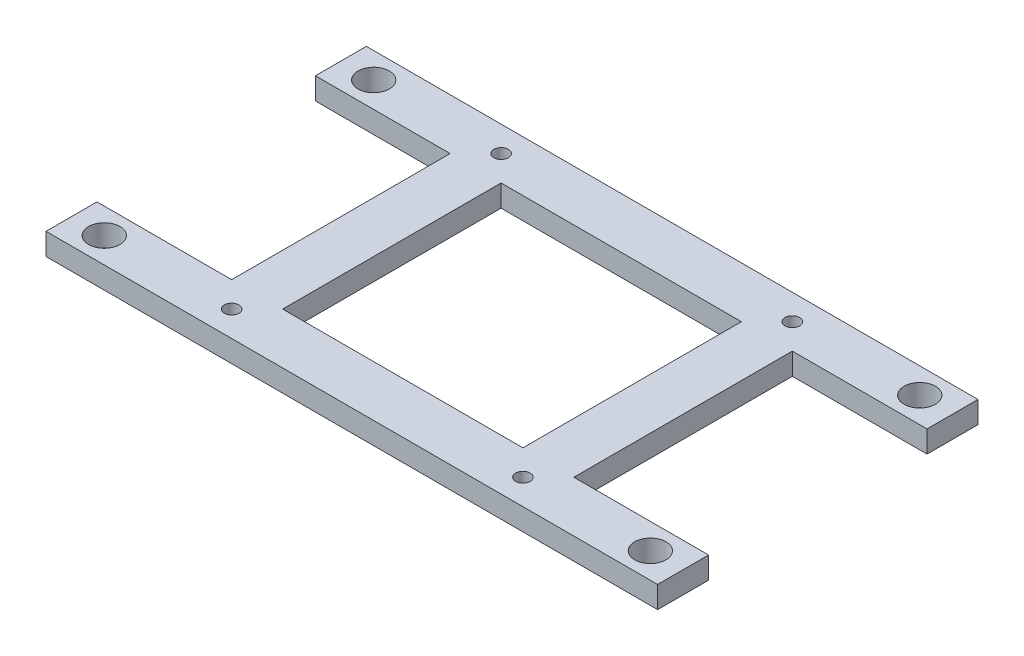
SolidWorks part; units mm, degrees
ref_plane "Front Plane" through (0, 0, 0) normal (0, 0, 1) x (1, 0, 0)
ref_plane "Top Plane" through (0, 0, 0) normal (0, 1, 0) x (1, 0, 0)
ref_plane "Right Plane" through (0, 0, 0) normal (1, 0, 0) x (0, 0, -1)
sketch "Sketch1" plane through (0, 0, 0) normal (0, 1, 0) x (1, 0, 0)
  line L0 (0, 18.5) -> (0, -18.5) construction
  line L1 (42, -18.5) -> (-42, -18.5) construction
  line L2 (42, -18.5) -> (42, 18.5) construction
  line L3 (42, 18.5) -> (-42, 18.5) construction
  line L4 (-42, -18.5) -> (-42, 18.5) construction
  line L5 (42, -18.5) -> (-42, 18.5) construction
  line L6 (42, 18.5) -> (-42, -18.5) construction
  line L7 (-42, 22) -> (42, 22)
  line L8 (42, 22) -> (42, 15)
  line L9 (42, 15) -> (23.5, 15)
  line L10 (23.5, 15) -> (23.5, -15)
  line L11 (23.5, -15) -> (42, -15)
  line L12 (42, -15) -> (42, -22)
  line L13 (42, -22) -> (-42, -22)
  line L14 (-42, -22) -> (-42, -15)
  line L15 (-42, -15) -> (-23.5, -15)
  line L16 (-23.5, -15) -> (-23.5, 15)
  line L17 (-23.5, 15) -> (-42, 15)
  line L18 (-42, 15) -> (-42, 22)
  line L19 (-16.5, 3.5843) -> (-23.5, 3.5843) construction
  line L20 (16.5, -15) -> (-16.5, -15)
  line L21 (16.5, -15) -> (16.5, 15)
  line L22 (16.5, 15) -> (-16.5, 15)
  line L23 (-16.5, -15) -> (-16.5, 15)
  line L24 (16.5, -15) -> (-16.5, 15) construction
  line L25 (16.5, 15) -> (-16.5, -15) construction
  line L26 (20, 18.5) -> (20, -18.5) construction
  circle A0 centre (-20, 18.5) radius 1
  circle A1 centre (20, 18.5) radius 1
  circle A2 centre (20, -18.5) radius 1
  circle A3 centre (-20, -18.5) radius 1
  circle A4 centre (-37.5, 18.5) radius 2.15
  circle A5 centre (-37.5, -18.5) radius 2.15
  circle A6 centre (37.5, -18.5) radius 2.15
  circle A7 centre (37.5, 18.5) radius 2.15
  point P0 (0, 0)
  point P16 (0, 0)
  dimension "D4" = 2
  dimension "D6" = 4.3
  dimension "D1" = 37
  dimension "D2" = 84
  dimension "D3" = 40
  dimension "D5" = 7
  dimension "D7" = 75
extrude "Boss-Extrude1" add sketch "Sketch1" along normal mid plane 3
